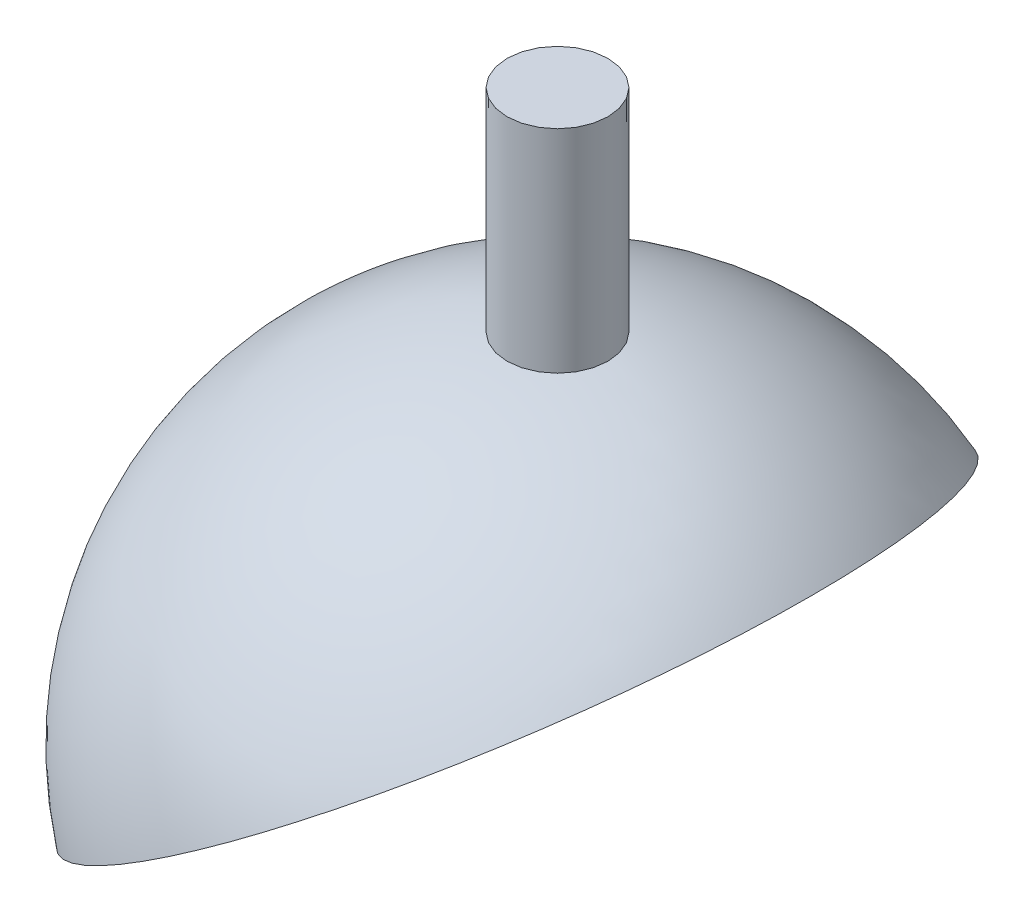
SolidWorks part; units mm, degrees
ref_plane "Płaszczyzna przednia" through (0, 0, 0) normal (0, 0, 1) x (1, 0, 0)
ref_plane "Płaszczyzna górna" through (0, 0, 0) normal (0, 1, 0) x (1, 0, 0)
ref_plane "Płaszczyzna prawa" through (0, 0, 0) normal (1, 0, 0) x (0, 0, -1)
sketch "Szkic1" plane through (0, 0, 0) normal (0, 0, 1) x (1, 0, 0)
  line L0 (35.1495, 35.56) -> (-46.2741, -18.9395)
  line L1 (-27.8116, 41.5513) -> (0, 0) construction
  line L2 (0, 0) -> (43.6504, -65.2148) construction
  line L3 (0, 50) -> (0, -60.8615) construction
  circle A0 centre (0, 0) radius 50
  point P8 (-27.8116, 41.5513)
  dimension "D1" = 100
  dimension "D2" = 40
  dimension "D3" = 38
sketch "Szkic3" plane through (0, 0, 0) normal (0, 0, 1) x (1, 0, 0)
  line L0 (-27.8116, 41.5513) -> (0, 0) construction
  line L3 (-27.8116, 41.5513) -> (0, 0) construction
  line L4 (35.1495, 35.56) -> (29.1921, 31.5725)
  line L5 (35.1495, 35.56) -> (-46.2741, -18.9395) construction
  line L6 (29.1921, 31.5725) -> (22.6945, 41.28)
  line L7 (22.6945, 41.28) -> (-10.0413, 41.8111)
  line L8 (-10.0413, 41.8111) -> (-23.918, 35.7341)
  line L9 (-27.8116, 41.5513) -> (-23.918, 35.7341)
  circle A0 centre (0, 0) radius 50 construction
  arc A1 (35.1495, 35.56) -> (-27.8116, 41.5513) centre (0, 0) ccw
revolve "Obrót1" add sketch "Szkic3" angle 360 about L3
sketch "Szkic4" plane through (0, 0, 0) normal (0, 0, 1) x (1, 0, 0)
  line L0 (0, 49.305) -> (6.9806, 49.305)
  line L1 (0, 50) -> (0, -60.8615) construction
  line L2 (6.9806, 49.305) -> (6.9806, 78.7656)
  line L3 (6.9806, 78.7656) -> (0, 78.7656)
  line L4 (0, 78.7656) -> (0, 49.305)
revolve "Obrót2" add sketch "Szkic4" angle 360 about L4
thread "Gwint1" pitch 1.25 start angle 0, offset 0, length 10, pitch 1.25, diameter 83.6421
ref_plane "Płaszczyzna1" through (29.1921, 31.5725, 0) normal (0, 0, 1) x (0.831, 0.5562, 0)
sketch "Profil gwintu1" plane through (29.1921, 31.5725, 0) normal (0, 0, 1) x (0.831, 0.5562, 0)
  line L0 (0, 0) -> (0, 1.25) construction
  line L1 (0, 0) -> (0.6766, 0.3906)
  line L2 (0.6766, 0.3906) -> (0.6766, 0.5469)
  line L3 (0.6766, 0.5469) -> (0, 0.9375)
  line L4 (0.6766, 0.4687) -> (0, 0.4687) construction
  line L11 (0, 0) -> (0, 0.9375)
  point P2 (0, 0)
  dimension "Pitch" = 1.25
  dimension "Profile_Angle" = 60
  dimension "Profile_Land" = 0.1562
  dimension "Profile_Height" = 0.6766
